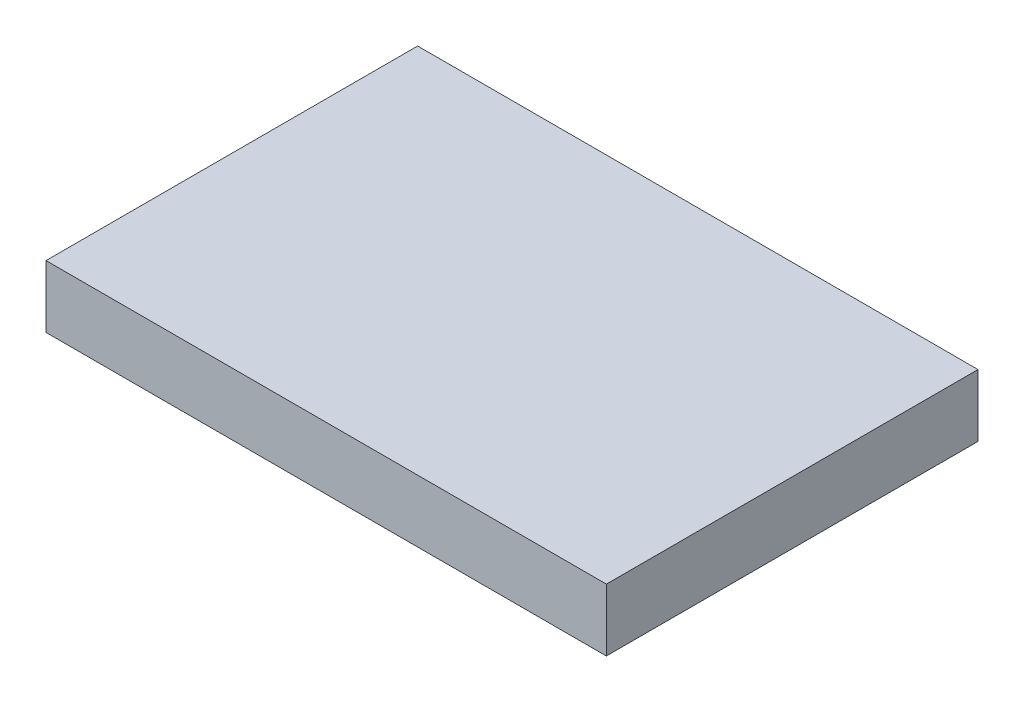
SolidWorks part; units mm, degrees
ref_plane "Front" through (0, 0, 0) normal (0, 0, 1) x (1, 0, 0)
ref_plane "Top" through (0, 0, 0) normal (0, 1, 0) x (1, 0, 0)
ref_plane "Right" through (0, 0, 0) normal (1, 0, 0) x (0, 0, -1)
sketch "Sketch1" plane through (0, 0, 0) normal (0, 1, 0) x (1, 0, 0)
  line L1 (0, 0) -> (7315.2, 0)
  line L2 (0, 0) -> (0, 4851.4)
  line L3 (0, 4851.4) -> (7315.2, 4851.4)
  line L4 (7315.2, 0) -> (7315.2, 4851.4)
  dimension "D1" = 7315.2
  dimension "D2" = 4851.4
extrude "Boss-Extrude1" add sketch "Sketch1" along normal blind 812.8
